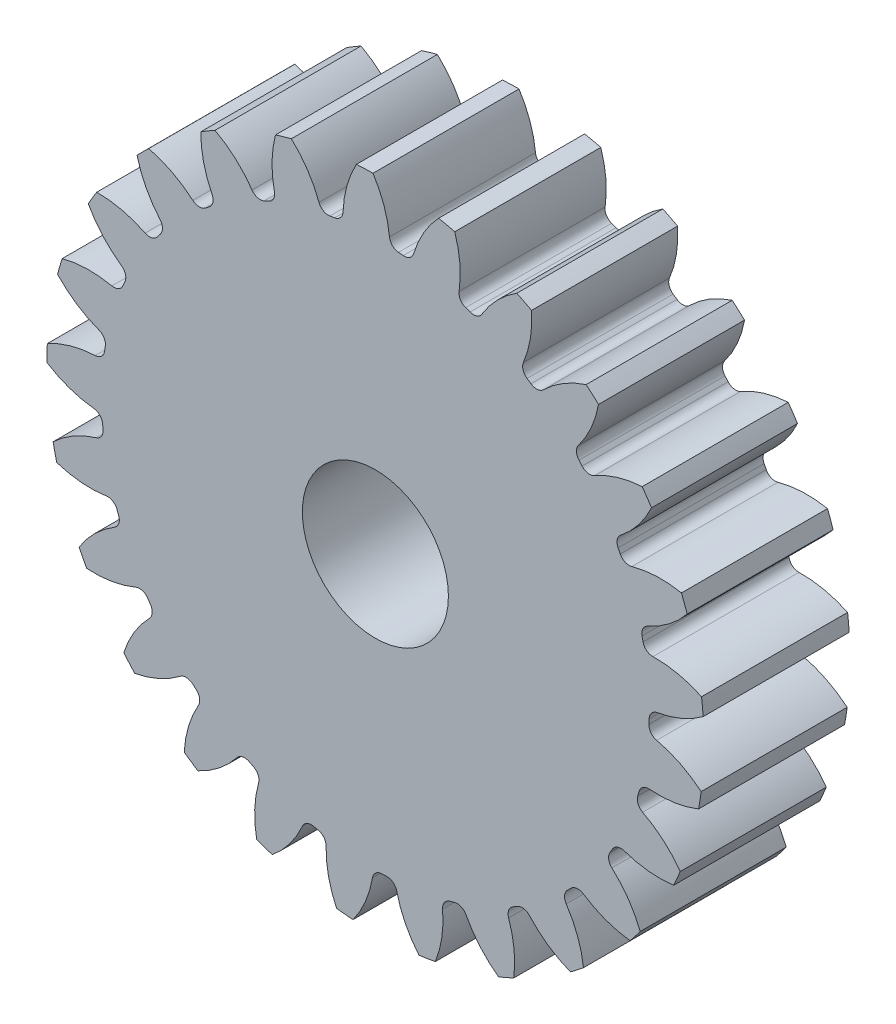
SolidWorks part; units mm, degrees
ref_plane "Front" through (0, 0, 0) normal (0, 0, 1) x (1, 0, 0)
ref_plane "Top" through (0, 0, 0) normal (0, 1, 0) x (1, 0, 0)
ref_plane "Right" through (0, 0, 0) normal (1, 0, 0) x (0, 0, -1)
sketch "Sketch3" plane through (0, 0, 0) normal (0, 0, 1) x (1, 0, 0)
  circle A0 centre (0, 0) radius 228.6
  dimension "od" = 457.2
extrude "gearBody" add sketch "Sketch3" along normal blind 101.6
sketch "Sketch2" plane through (0, 0, 0) normal (0, 0, 1) x (1, 0, 0)
  line L0 (0, 0) -> (183.7611, 76.1163) construction
  line L1 (227.1827, -30.268) -> (0, 0) construction
  line L2 (0, 0) -> (36.3143, 0) construction
  line L3 (211.5562, 6.837) -> (210.7524, -19.6525) construction
  line L5 (211.1543, -6.4077) -> (0, 0) construction
  line L7 (0, 0) -> (198.9016, 0) construction
  arc A0 (198.8787, 3.0161) -> (198.3299, -15.0699) centre (0, 0) ccw construction
  arc A1 (228.0381, 16.0186) -> (226.6472, -29.8166) centre (0, 0) ccw construction
  arc A2 (211.5562, 6.837) -> (210.7524, -19.6525) centre (0, 0) ccw construction
  arc A3 (190.3553, -7.4226) -> (190.4551, -4.1335) centre (0, 0) ccw
  arc A4 (227.1827, -30.268) -> (195.6838, -14.4046) centre (178.8075, -87.1189) ccw
  arc A5 (227.1827, -30.268) -> (228.6, 16.4367) centre (0, 0) ccw
  arc A6 (228.6, 16.4367) -> (196.1972, 2.5125) centre (183.7611, 76.1163) cw
  arc A7 (190.4551, -4.1335) -> (196.1972, 2.5125) centre (197.3454, -4.2831) cw
  arc A8 (195.6838, -14.4046) -> (190.3553, -7.4226) centre (197.242, -7.6912) cw
  point P6 (228.6, 16.4367)
  point P22 (227.1827, -30.268)
  dimension "baseDia" = 397.8032
  dimension "od" = 457.2
  dimension "pd" = 423.3333
  dimension "rd" = 381
  dimension "rFillet" = 6.8919
  dimension "pointX" = 228.6
  dimension "pointY" = 16.4367
  dimension "CTT" = 26.4896
  dimension "flankCenterAngle" = 22.5
extrude "toothCut" cut sketch "Sketch2" along normal through all
pattern_circular "CirPattern1" count 25 over 360 about axis through (0, 0, 0) along (0, 0, 1) of "toothCut"
sketch "hub1Dia" plane through (0, 0, 0) normal (0, 0, -1) x (-1, 0, 0)
  circle A0 centre (0, 0) radius 12.7
  dimension "hub1Dia" = 25.4
sketch "hub2Dia" plane through (0, 0, 101.6) normal (0, 0, 1) x (1, 0, 0)
  circle A0 centre (0, 0) radius 12.7
  dimension "hub2dia" = 25.4
sketch "boreDia" plane through (0, 0, 0) normal (0, 0, 1) x (1, 0, 0)
  circle A0 centre (0, 0) radius 50.8
  dimension "boreDia" = 101.6
extrude "bore" cut sketch "boreDia" against normal mid plane 25400
